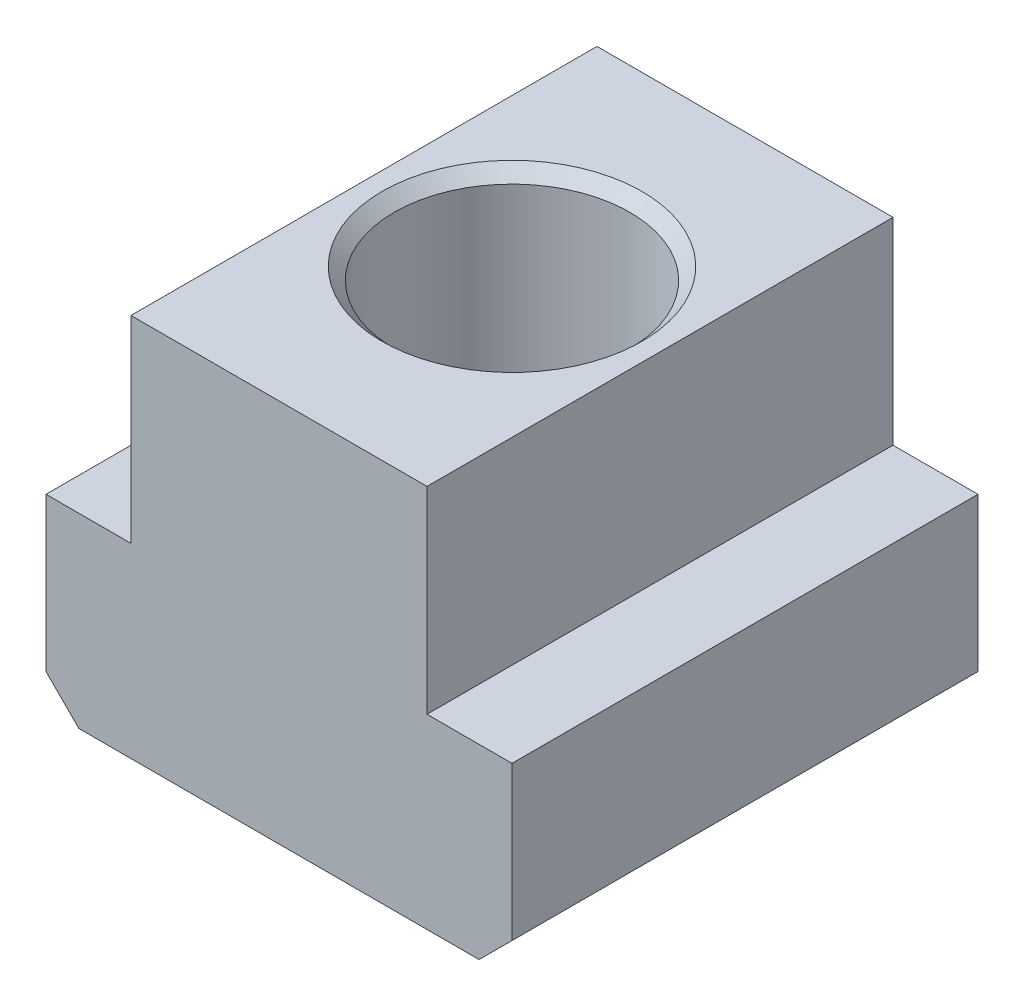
SolidWorks part; units mm, degrees
ref_plane "Plane1" through (0, 0, 0) normal (0, 0, 1) x (1, 0, 0)
ref_plane "Plane2" through (0, 0, 0) normal (0, 1, 0) x (1, 0, 0)
ref_plane "Plane3" through (0, 0, 0) normal (1, 0, 0) x (0, 0, -1)
sketch "BaseNutSke" plane through (0, 0, 0) normal (0, 0, 1) x (1, 0, 0)
  line L0 (27, 34) -> (42.5, 34)
  line L1 (-42.5, 0) -> (42.5, 0)
  line L2 (-42.5, 0) -> (-42.5, 34)
  line L3 (-42.5, 34) -> (-27, 34)
  line L4 (42.5, 0) -> (42.5, 34)
  line L6 (-27, 34) -> (-27, 70)
  line L7 (-27, 70) -> (27, 70)
  line L8 (27, 34) -> (27, 70)
  point P11 (27, 34)
  dimension "D1" = 42.5
  dimension "Width" = 85
  dimension "Height" = 34
  dimension "Thickness" = 70
  dimension "Tongue_width" = 54
  dimension "D2" = 15.5
extrude "BaseNut" add sketch "BaseNutSke" against normal blind 85
chamfer "Chamfers" distance 6 2 edges at (42.5, 0, -42.5) (-42.5, 0, -42.5)
sketch "HoleSke" plane through (0, 70, 0) normal (0, 1, 0) x (-1, 0, 0)
  line L1 (-27, 0) -> (27, 0) construction
  line L2 (0, -85) -> (0, 0) construction
  line L3 (-27, -85) -> (27, -85) construction
  circle A0 centre (0, -42.5) radius 21.5
  dimension "Thread_min" = 43
  dimension "D2" = 42.5
extrude "TappedHole" cut sketch "HoleSke" against normal through all
chamfer "Chamfer1" distance 2.2 angle 45 2 edges at (-21.5, 70, -42.5) (-21.5, 0, -42.5)
sketch "ThdSchSke" plane through (0, 0, 0) normal (1, 0, 0) x (0, 0, -1)
  line L0 (66.5, 3.6434) -> (64, 5.0868)
  line L1 (64, 5.0868) -> (42.5, 5.0868)
  line L2 (42.5, 5.0868) -> (42.5, 2.2)
  line L3 (42.5, 2.2) -> (64, 2.2)
  line L4 (64, 2.2) -> (66.5, 3.6434)
  line L5 (85, 70) -> (0, 70) construction
  line L6 (42.5, 47.625) -> (42.5, 70) construction
  line L8 (21, 2.2) -> (64, 2.2) construction
  dimension "D2" = 43
  dimension "D3" = 60
  dimension "ThreadN" = 48
revolve "ThreadSchematic" [suppressed] cut sketch "ThdSchSke" angle 360 about L6
pattern_linear "ThdSchPat" [suppressed]
equation "\"D1@BaseNutSke\" = \"Width@BaseNutSke\" / 2"
equation "\"D2@BaseNutSke\" =  ( \"Width@BaseNutSke\" - \"Tongue_width@BaseNutSke\" )  / 2"
equation "\"Length@BaseNut\" = \"Width@BaseNutSke\""
equation "\"D2@HoleSke\" = \"Length@BaseNut\" / 2"
equation "\"D1@Chamfer1\" = (\"Tongue_width@BaseNutSke\"-\"Thread_min@HoleSke\")/5"
equation "\"D2@ThdSchSke\" = \"Thread_min@HoleSke\""
equation "\"ThreadN@ThdSchSke\" = \"Thread_nominal@ThreadCosmetic\""
equation "\"Num_threads@ThdSchPat\" =  int( \"Thickness@BaseNutSke\" / \"Advance@ThdSchPat\" ) "
